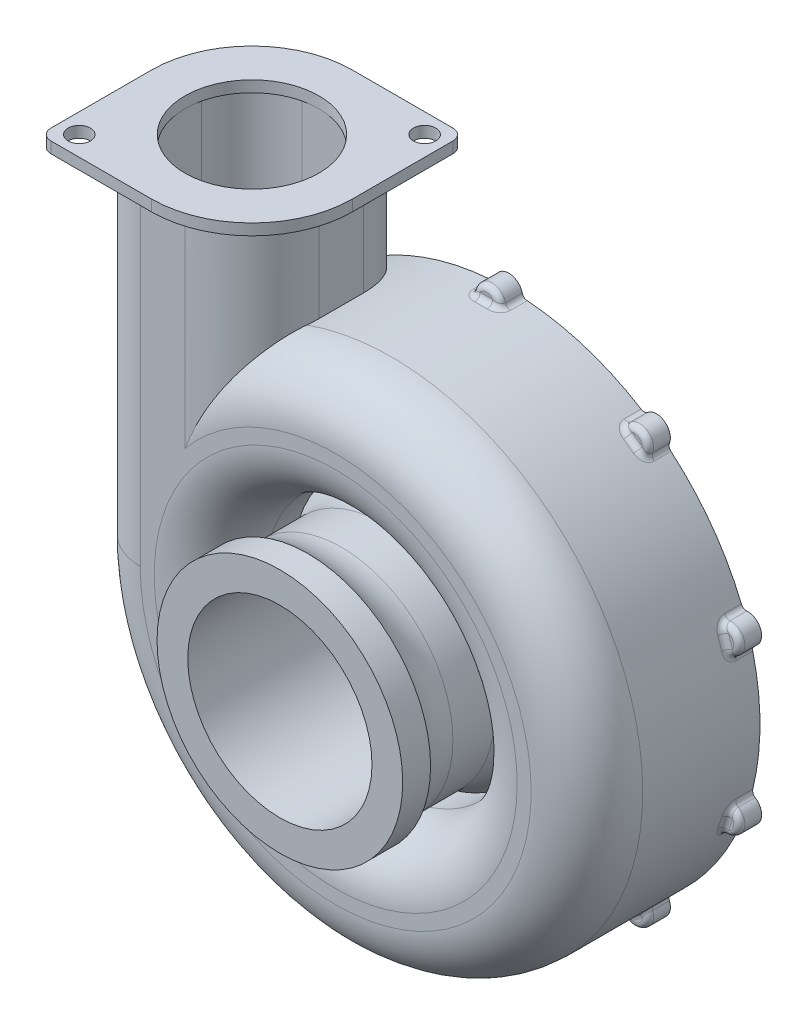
SolidWorks part; units mm, degrees
ref_plane "Front Plane" through (0, 0, 0) normal (0, 0, 1) x (1, 0, 0)
ref_plane "Top Plane" through (0, 0, 0) normal (0, 1, 0) x (1, 0, 0)
ref_plane "Right Plane" through (0, 0, 0) normal (1, 0, 0) x (0, 0, -1)
sketch "Sketch1" plane through (0, 0, 0) normal (0, 0, 1) x (1, 0, 0)
  line L2 (-45, 0) -> (-45, 60)
  line L3 (-45, 60) -> (-15, 60)
  line L4 (-15, 42.4264) -> (-15, 60)
  arc A0 (-45, 0) -> (-15, 42.4264) centre (0, 0) ccw
  dimension "D1" = 90
  dimension "D2" = 30
  dimension "D3" = 60
extrude "Boss-Extrude1" add sketch "Sketch1" along normal blind 30
sketch "Sketch2" plane through (0, 0, 30) normal (0, 0, 1) x (1, 0, 0)
  circle A0 centre (0, 0) radius 22.5
  dimension "D1" = 45
extrude "Cut-Extrude1" cut sketch "Sketch2" against normal blind 15
fillet "Fillet1" radius 10 3 edges at (-45, 30, 30) (22.5, 0, 30) (36.7423, -25.9808, 30)
sketch "Sketch3" plane through (0, 0, 15) normal (0, 0, 1) x (1, 0, 0)
  circle A0 centre (0, 0) radius 20
  dimension "D1" = 40
extrude "Boss-Extrude2" add sketch "Sketch3" along normal blind 25
fillet "Fillet2" radius 10 1 edges at (-15, 51.2132, 0)
fillet "Fillet3" radius 12 1 edges at (-15, 45.8114, 30)
sketch "Sketch4" plane through (0, 60, 0) normal (0, 1, 0) x (1, 0, 0)
  line L0 (-45, -20) -> (-45, 0) construction
  line L1 (-25, 0) -> (-45, 0) construction
  line L2 (-45, -20) -> (-45, -12)
  line L3 (-25, 0) -> (-33, 0)
  line L4 (-25, 0) -> (-25, 9.4378)
  line L5 (-25, 9.4378) -> (-57.7536, 9.4378)
  line L6 (-57.7536, 9.4378) -> (-57.7536, -20)
  line L7 (-57.7536, -20) -> (-45, -20)
  arc A0 (-45, -12) -> (-33, 0) centre (-33, -12) cw
  dimension "D1" = 12
extrude "Cut-Extrude2" cut sketch "Sketch4" against normal up to surface (105.001 mm away)
sketch "Sketch5" plane through (0, 0, 0) normal (0, 0, -1) x (-1, 0, 0)
  circle A0 centre (0, 0) radius 45
extrude "Boss-Extrude3" add sketch "Sketch5" along normal blind 1
sketch "Sketch6" plane through (0, 0, 40) normal (0, 0, 1) x (1, 0, 0)
  circle A0 centre (0, 0) radius 16.5
  dimension "D1" = 33
extrude "Cut-Extrude3" cut sketch "Sketch6" against normal through all
shell "Shell1" thickness 3
sketch "Sketch7" plane through (0, 0, -1) normal (0, 0, -1) x (-1, 0, 0)
  circle A0 centre (0, 0) radius 25.5
  circle A1 centre (0, 0) radius 25.5 construction
  circle A2 centre (0, 0) radius 19.5 construction
  circle A3 centre (0, 0) radius 19.5
extrude "Boss-Extrude4" add sketch "Sketch7" against normal up to surface (13 mm away)
sketch "Sketch8" plane through (0, 0, -1) normal (0, 0, -1) x (-1, 0, 0)
  circle A0 centre (0, 0) radius 25.5 construction
  circle A1 centre (0, 0) radius 16.5 construction
  circle A2 centre (0, 0) radius 25.5
  circle A3 centre (0, 0) radius 16.5
extrude "Cut-Extrude4" cut sketch "Sketch8" against normal blind 5
fillet "Fillet4" radius 10 1 edges at (-16.5, 0, 4)
sketch "Sketch9" plane through (0, 0, -1) normal (0, 0, -1) x (-1, 0, 0)
  circle A0 centre (0, 45) radius 2.5
  circle A1 centre (0, 0) radius 45 construction
  circle A2 centre (26.4503, 36.4058) radius 2.5
  circle A3 centre (42.7975, 13.9058) radius 2.5
  circle A4 centre (42.7975, -13.9058) radius 2.5
  circle A5 centre (26.4503, -36.4058) radius 2.5
  circle A6 centre (0, -45) radius 2.5
  circle A7 centre (-26.4503, -36.4058) radius 2.5
  circle A8 centre (-42.7975, -13.9058) radius 2.5
  circle A9 centre (-42.7975, 13.9058) radius 2.5
  circle A10 centre (-26.4503, 36.4058) radius 2.5
  point P25 (0, 0)
  dimension "D1" = 5
  dimension "D2" = 10
extrude "Boss-Extrude5" add sketch "Sketch9" against normal up to surface (4 mm away)
fillet "Fillet5" radius 1 38 edges at (26.4503, 36.4058, 3) (42.7975, 13.9058, 3) (42.7975, -13.9058, 3) (26.4503, -36.4058, 3) (0, -45, 3) (-26.4503, -36.4058, 3) (-42.7975, -13.9058, 3) (-42.7975, 13.9058, 3) (0, 45, 3) (27.9198, 38.4283, 3) (45.1752, 14.6783, 3) (45.1752, -14.6783, 3) (27.9198, -38.4283, 3) (0, -47.5, 3) (-27.9198, -38.4283, 3) (-45.1752, -14.6783, 3) (-45.1752, 14.6783, 3) (0, 47.5, 3) (2.499, 44.9306, 1) (-2.499, 44.9306, 1) (-24.3878, 37.8185, -0.4906) (-28.4313, 34.8807, -0.5) (-41.9593, 16.261, 1) (-43.5037, 11.5076, 1) (-43.5037, -11.5076, 1) (-41.9593, -16.261, 1) (-28.4313, -34.8807, 1) (-24.3878, -37.8185, 1) (-2.499, -44.9306, 1) (2.499, -44.9306, 1) (24.3878, -37.8185, 1) (28.4313, -34.8807, 1) (41.9593, -16.261, 1) (43.5037, -11.5076, 1) (43.5037, 11.5076, 1) (41.9593, 16.261, 1) (28.4313, 34.8807, 1) (24.3878, 37.8185, 1)
sketch "Sketch10" plane through (0, 0, -1) normal (0, 0, -1) x (-1, 0, 0)
  circle A0 centre (0, 45) radius 1.5
  circle A1 centre (26.4503, 36.4058) radius 1.5
  circle A2 centre (42.7975, 13.9058) radius 1.5
  circle A3 centre (42.7975, -13.9058) radius 1.5
  circle A4 centre (26.4503, -36.4058) radius 1.5
  circle A5 centre (0, -45) radius 1.5
  circle A6 centre (-26.4503, -36.4058) radius 1.5
  circle A7 centre (-42.7975, -13.9058) radius 1.5
  circle A8 centre (-42.7975, 13.9058) radius 1.5
  circle A9 centre (-26.4503, 36.4058) radius 1.5
  point P23 (0, 0)
  dimension "D1" = 3
  dimension "D2" = 10
extrude "Cut-Extrude5" cut sketch "Sketch10" against normal blind 3.5
sketch "Sketch11" plane through (0, 60, 0) normal (0, 1, 0) x (1, 0, 0)
  line L0 (-42.0711, -27.0711) -> (-17.9289, -2.9289) construction
  line L2 (-31, 4) -> (-13, 4)
  line L3 (-49, -14) -> (-49, -32)
  line L4 (-47, -34) -> (-29, -34)
  line L5 (-11, 2) -> (-11, -16)
  line L6 (-49, 4) -> (-11, -34) construction
  line L7 (-49, -34) -> (-11, 4) construction
  arc A0 (-45, -20) -> (-35, -30) centre (-35, -20) ccw construction
  arc A1 (-15, -10) -> (-25, 0) centre (-25, -10) ccw construction
  circle A2 centre (-30, -15) radius 12
  arc A3 (-13, 4) -> (-11, 2) centre (-13, 2) cw
  arc A4 (-49, -32) -> (-47, -34) centre (-47, -32) ccw
  arc A5 (-29, -34) -> (-11, -16) centre (-29, -16) ccw
  arc A6 (-31, 4) -> (-49, -14) centre (-31, -14) ccw
  circle A7 centre (-45.4645, -30.4645) radius 2
  circle A8 centre (-14.5355, 0.4645) radius 2
  dimension "D1" = 24
  dimension "D4" = 2
  dimension "D5" = 18
  dimension "D6" = 4
  dimension "D7" = 5
  dimension "D2" = 38
  dimension "D3" = 38
  dimension "D8" = 5
extrude "Boss-Extrude6" add sketch "Sketch11" along normal blind 2
fillet "Fillet6" radius 1 8 edges at (-18.5147, 60, 26.4853) (-15, 60, 14) (-17.9289, 60, 2.9289) (-29, 60, 0) (-41.4853, 60, 3.5147) (-45, 60, 16) (-42.0711, 60, 27.0711) (-31, 60, 30)
sketch "Sketch12" plane through (0, 0, 40) normal (0, 0, 1) x (1, 0, 0)
  circle A0 centre (0, 0) radius 22
  circle A1 centre (0, 0) radius 20 construction
  circle A2 centre (0, 0) radius 20
  dimension "D1" = 44
extrude "Boss-Extrude7" add sketch "Sketch12" against normal blind 5
fillet "Fillet7" radius 10 2 edges at (20, 0, 35) (20, 0, 15)
